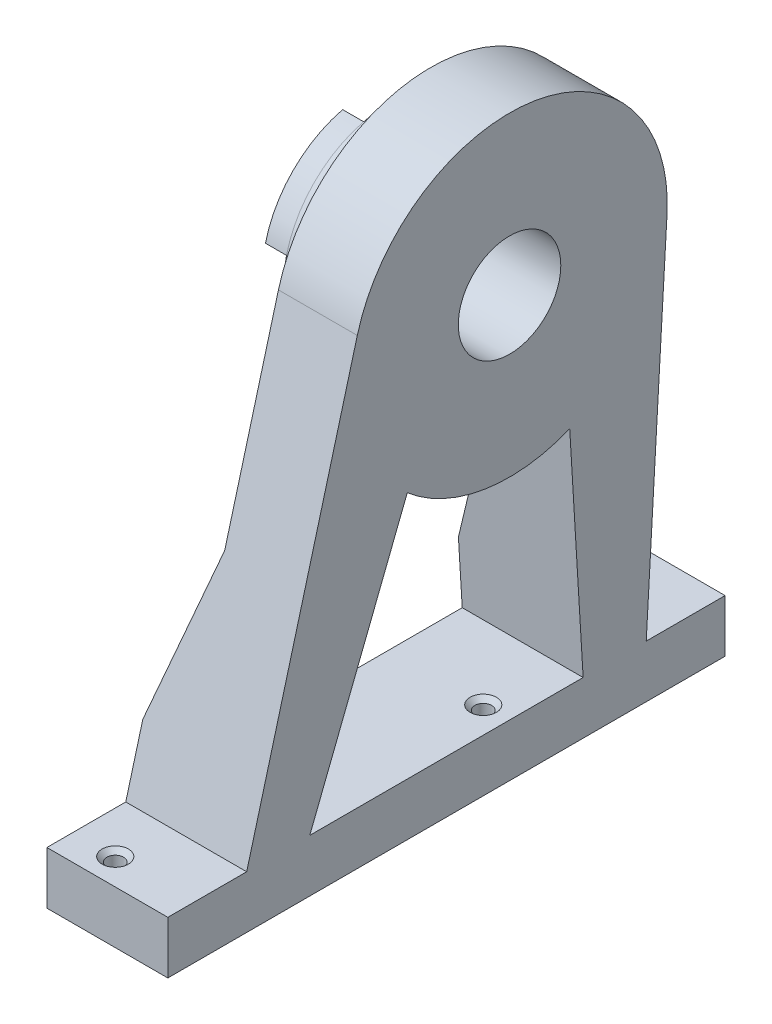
SolidWorks part; units mm, degrees
ref_plane "Front" through (0, 0, 0) normal (0, 0, 1) x (1, 0, 0)
ref_plane "Top" through (0, 0, 0) normal (0, 1, 0) x (1, 0, 0)
ref_plane "Right" through (0, 0, 0) normal (1, 0, 0) x (0, 0, -1)
sketch "Sketch1" plane through (0, 0, 0) normal (1, 0, 0) x (0, 0, -1)
  line L2 (-65, 10) -> (-50, 10)
  line L9 (-50, 10) -> (-28.9605, 87.8289)
  line L10 (-38, 10) -> (14, 10)
  line L12 (-38, 10) -> (-19.4555, 57.164)
  line L13 (14, 10) -> (11.4444, 52.2687)
  line L14 (-65, 10) -> (-65, 0)
  line L15 (41, 10) -> (41, 0)
  line L16 (0, 50) -> (0, 0) construction
  line L18 (41, 10) -> (26, 10)
  line L19 (26, 10) -> (29.9499, 78.2671)
  line L20 (41, 0) -> (-65, 0)
  arc A2 (29.9499, 78.2671) -> (-28.9605, 87.8289) centre (0, 80) ccw
  arc A3 (-19.4555, 57.164) -> (11.4444, 52.2687) centre (0, 80) ccw
  point P1 (0, 0)
  point P11 (-65, 5)
  dimension "D1" = 65
  dimension "D5" = 30
  dimension "D6" = 10
  dimension "D7" = 12
  dimension "D2" = 41
  dimension "D3" = 15
  dimension "D9" = 12
extrude "Boss-Extrude1" add sketch "Sketch1" against normal blind 25
sketch "Sketch4" plane through (0, 0, 0) normal (0, 0, -1) x (-1, 0, 0)
  line L14 (25, 15) -> (25, 110)
  line L15 (25, 110) -> (15, 110)
  line L16 (15, 110) -> (15, 50)
  line L17 (15, 50) -> (25, 15)
  point P3 (27, 15)
  dimension "D1" = 15
  dimension "D2" = 60
  dimension "D3" = 10
  dimension "D4" = 15
  dimension "D5" = 95
extrude "Cut-Extrude1" cut sketch "Sketch4" against normal through all both and the other way through all
sketch "Sketch11" plane through (0, 0, 0) normal (1, 0, 0) x (0, 0, -1)
  circle A0 centre (0, 80) radius 20
  point P2 (0, 0)
  dimension "D1" = 80
  dimension "D2" = 40
extrude "Boss-Extrude2" add sketch "Sketch11" against normal blind 27
sketch "Sketch12" plane through (0, 0, 0) normal (1, 0, 0) x (0, 0, -1)
  circle A0 centre (0, 80) radius 9.75
  point P2 (0, 0)
  dimension "D1" = 19.5
  dimension "D2" = 80
extrude "Cut-Extrude2" cut sketch "Sketch12" against normal blind 19
sketch "Sketch13" plane through (-27, 0, 0) normal (-1, 0, 0) x (0, 0, 1)
  line L1 (-9.25, 75.25) -> (9.25, 75.25)
  line L2 (-9.25, 75.25) -> (-9.25, 84.75)
  line L3 (-9.25, 84.75) -> (9.25, 84.75)
  line L4 (9.25, 75.25) -> (9.25, 84.75)
  line L5 (0, 84.75) -> (0, 75.25) construction
  line L6 (-9.25, 80) -> (9.25, 80) construction
  point P0 (0, 80)
  dimension "D1" = 18.5
  dimension "D2" = 9.5
extrude "Cut-Extrude3" cut sketch "Sketch13" against normal blind 8
fillet "Fillet6" radius 3 4 edges at (-23, 84.75, -9.25) (-23, 75.25, -9.25) (-23, 84.75, 9.25) (-23, 75.25, 9.25)
sketch "Sketch14" plane through (-27, 0, 0) normal (-1, 0, 0) x (0, 0, 1)
  line L0 (-6.25, 75.25) -> (6.25, 75.25) construction
  line L1 (6.25, 84.75) -> (-6.25, 84.75) construction
  line L2 (-19.4278, 75.25) -> (-4.75, 75.25)
  line L3 (19.4278, 84.75) -> (4.75, 84.75)
  line L4 (4.75, 99.4278) -> (4.75, 84.75)
  line L6 (-4.75, 75.25) -> (-4.75, 60.5722)
  circle A0 centre (0, 80) radius 20 construction
  arc A1 (-19.4278, 75.25) -> (-4.75, 60.5722) centre (0, 80) ccw
  arc A2 (19.4278, 84.75) -> (4.75, 99.4278) centre (0, 80) ccw
  point P7 (-4.75, 67.9111)
  dimension "D1" = 9.5
  dimension "D2" = 4.75
extrude "Cut-Extrude4" cut sketch "Sketch14" against normal blind 4 flip side to cut
fillet "Fillet7" radius 8 1 edges at (-15, 100, 0)
hole_wizard "CSK for M3 Cross Countersunk Head Screw1" positions "Sketch9" profile "Sketch10" countersink size "M3" standard "AS"
sketch "Sketch9" plane through (0, 10, 0) normal (0, 1, 0) x (1, 0, 0)
  point P0 (-5, 0)
  point P2 (-15, 36)
  point P4 (-15, -60)
  dimension "D1" = 10
  dimension "D2" = 36
  dimension "D3" = 96
  dimension "D4" = 5
sketch "Sketch10" plane through (-5, 10, 0) normal (1, 0, 0) x (0, 0, 1)
  line L0 (0, 0) -> (0, 10)
  line L1 (0, 10) -> (1.6, 10)
  line L2 (1.6, 10) -> (1.6, 0.9)
  line L3 (1.6, 0.9) -> (2.5, 0)
  line L5 (2.5, 0) -> (0, 0)
  line L6 (-1.6, 0.9) -> (-2.5, 0) construction
  line L11 (0, -6.35) -> (0, 107.95) construction
  dimension "Thru Hole Dia." = 3.2
  dimension "Thru Hole Depth" = 10
  dimension "Near C'Sink Dia." = 5
  dimension "Near C'Sink Angle" = 90
